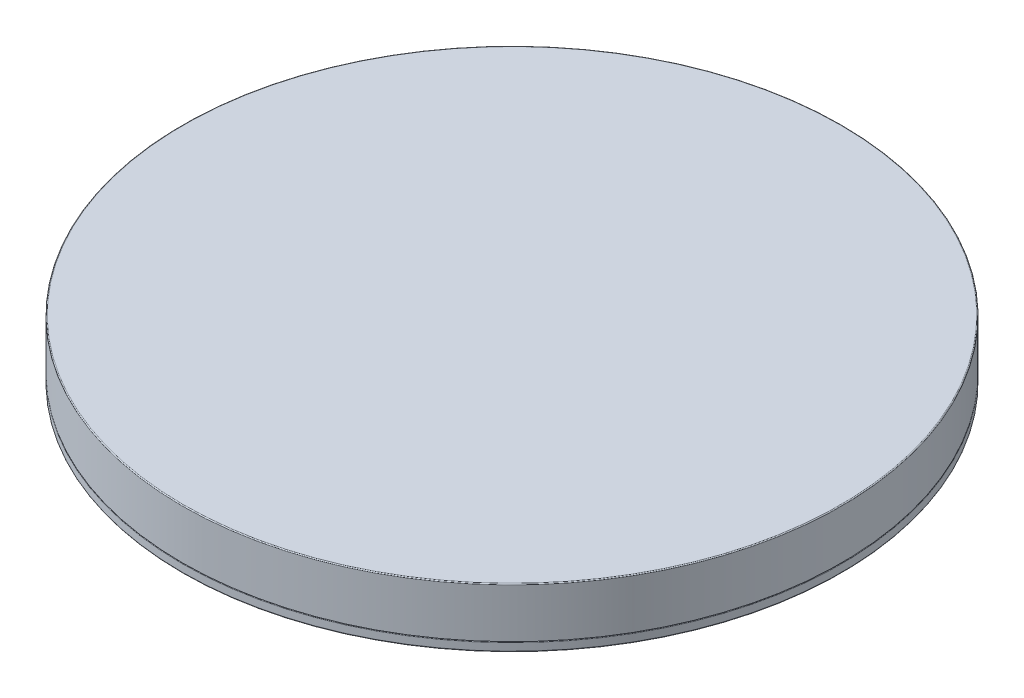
SolidWorks part; units mm, degrees
ref_plane "Alzado" through (0, 0, 0) normal (0, 0, 1) x (1, 0, 0)
ref_plane "Planta" through (0, 0, 0) normal (0, 1, 0) x (1, 0, 0)
ref_plane "Vista lateral" through (0, 0, 0) normal (1, 0, 0) x (0, 0, -1)
sketch "Croquis1" plane through (0, 0, 0) normal (0, 1, 0) x (1, 0, 0)
  circle A0 centre (0, 0) radius 72.5
extrude "Saliente-Extruir1" add sketch "Croquis1" along normal blind 2
fillet "Redondeo1" radius 0.2 2 edges at (0, 0, 72.5) (0, 2, 72.5)
sketch "Croquis2" plane through (0, 0, 0) normal (0, -1, 0) x (1, 0, 0)
  circle A0 centre (0, 0) radius 7.5
  circle A1 centre (0, 0) radius 11
  dimension "D1" = 22
  dimension "D2" = 15
extrude "Saliente-Extruir2" add sketch "Croquis2" along normal blind 4 contours A1 A0
fillet "Redondeo2" radius 0.2 3 edges at (0, 0, 11) (0, -4, -7.5) (0, -4, -11)
sketch "Croquis3" plane through (0, 2, 0) normal (0, 1, 0) x (1, 0, 0)
  circle A0 centre (0, 0) radius 72.5
extrude "Saliente-Extruir3" add sketch "Croquis3" along normal blind 11 separate body
fillet "Redondeo3" radius 0.2 1 edges at (0, 13, 72.5)
